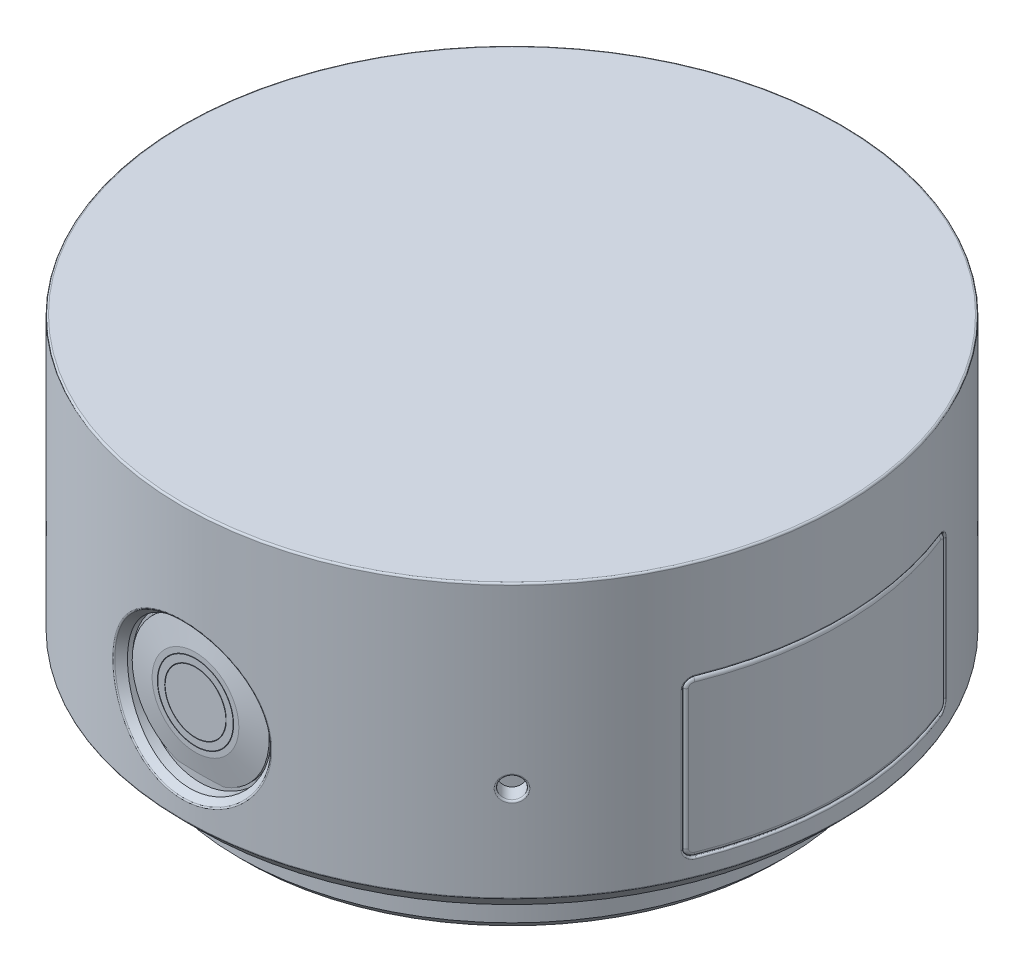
SolidWorks part; units mm, degrees
ref_plane "前视基准面" through (0, 0, 0) normal (0, 0, 1) x (1, 0, 0)
ref_plane "上视基准面" through (0, 0, 0) normal (0, 1, 0) x (1, 0, 0)
ref_plane "右视基准面" through (0, 0, 0) normal (1, 0, 0) x (0, 0, -1)
imported_body "EC63-末端-1/EC66末端法兰-2/ELITE040060-024末端法兰-1-solid1"
imported_body "EC63-末端-1/EC66末端法兰-2/170010500017--ELITE040060-023橡胶套-1-solid1"
imported_body "EC63-末端-1/EC66末端法兰-2/170010500017--ELITE040060-023橡胶套-2-solid1"
imported_body "EC63-末端-1/EC66末端法兰-2/红波按钮HBGQ12SF-10WE-1-solid6"
imported_body "EC63-末端-1/EC66末端法兰-2/红波按钮HBGQ12SF-10WE-1-solid7"
imported_body "EC63-末端-1/EC66末端法兰-2/红波按钮HBGQ12SF-10WE-1-solid8"
imported_body "EC63-末端-1/EC66末端法兰-2/红波按钮HBGQ12SF-10WE-1-solid9"
imported_body "EC63-末端-1/EC66末端法兰-2/红波按钮HBGQ12SF-10WE-2-solid6"
imported_body "EC63-末端-1/EC66末端法兰-2/红波按钮HBGQ12SF-10WE-2-solid7"
imported_body "EC63-末端-1/EC66末端法兰-2/红波按钮HBGQ12SF-10WE-2-solid8"
imported_body "EC63-末端-1/EC66末端法兰-2/红波按钮HBGQ12SF-10WE-2-solid9"
surface "曲面填充1" [suppressed]
sketch "草图1" plane through (0, 0, 0) normal (0, 0, 1) x (1, 0, 0)
  circle A0 centre (28.2234, 97.5417) radius 60.8127
extrude "凸台-拉伸1" [suppressed] add sketch "草图1" along normal mid plane 90 separate body
sketch "草图3" plane through (0, 61.4649, 0) normal (0, 1, 0) x (1, 0, 0)
  circle A0 centre (29.5156, 0) radius 10.5 construction
  circle A1 centre (29.5156, 0) radius 10.5
extrude "凸台-拉伸2" add sketch "草图3" along normal up to surface (1 mm away)
sketch "草图5" plane through (0, 93.9649, 0) normal (0, 1, 0) x (1, 0, 0)
  circle A0 centre (29.5156, 0) radius 36
  dimension "D1" = 72
extrude "凸台-拉伸6" add sketch "草图5" against normal up to surface (33.5 mm away)
